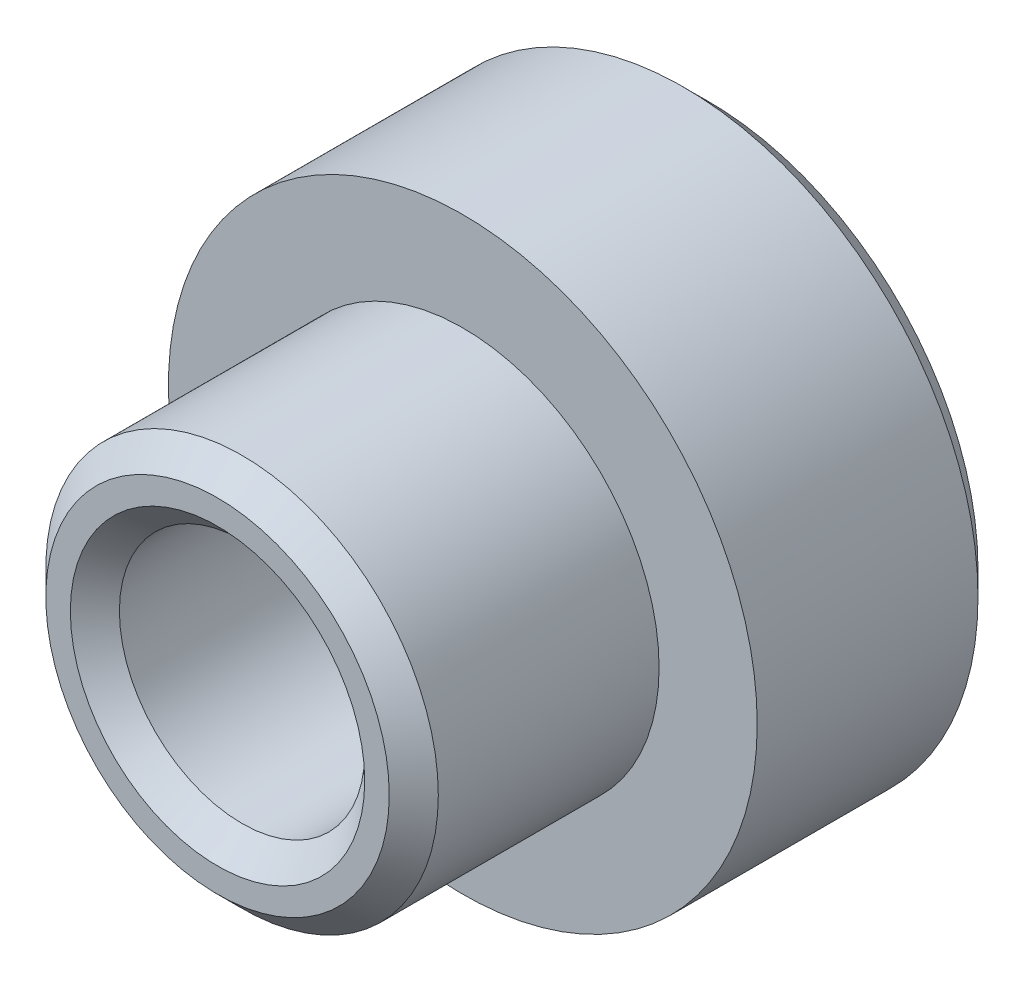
SolidWorks part; units mm, degrees
ref_plane "Plan1" through (0, 0, 0) normal (0, 0, 1) x (1, 0, 0)
ref_plane "Plan2" through (0, 0, 0) normal (0, 1, 0) x (1, 0, 0)
ref_plane "Plan3" through (0, 0, 0) normal (1, 0, 0) x (0, 0, -1)
sketch "Esquisse1" plane through (0, 0, 0) normal (0, 0, 1) x (1, 0, 0)
  circle A0 centre (0, 0) radius 2.5
  circle A1 centre (0, 0) radius 6
  dimension "D1" = 12
  dimension "D2" = 5
extrude "Base-Extrusion" add sketch "Esquisse1" along normal blind 5
sketch "Esquisse2" plane through (0, 0, 5) normal (0, 0, 1) x (1, 0, 0)
  circle A0 centre (0, 0) radius 4
  circle A1 centre (0, 0) radius 2.5 construction
  circle A2 centre (0, 0) radius 2.5
  dimension "D1" = 8
extrude "Boss.-Extru.1" add sketch "Esquisse2" along normal blind 5
chamfer "Chanfrein1" distance 0.5 angle 45
